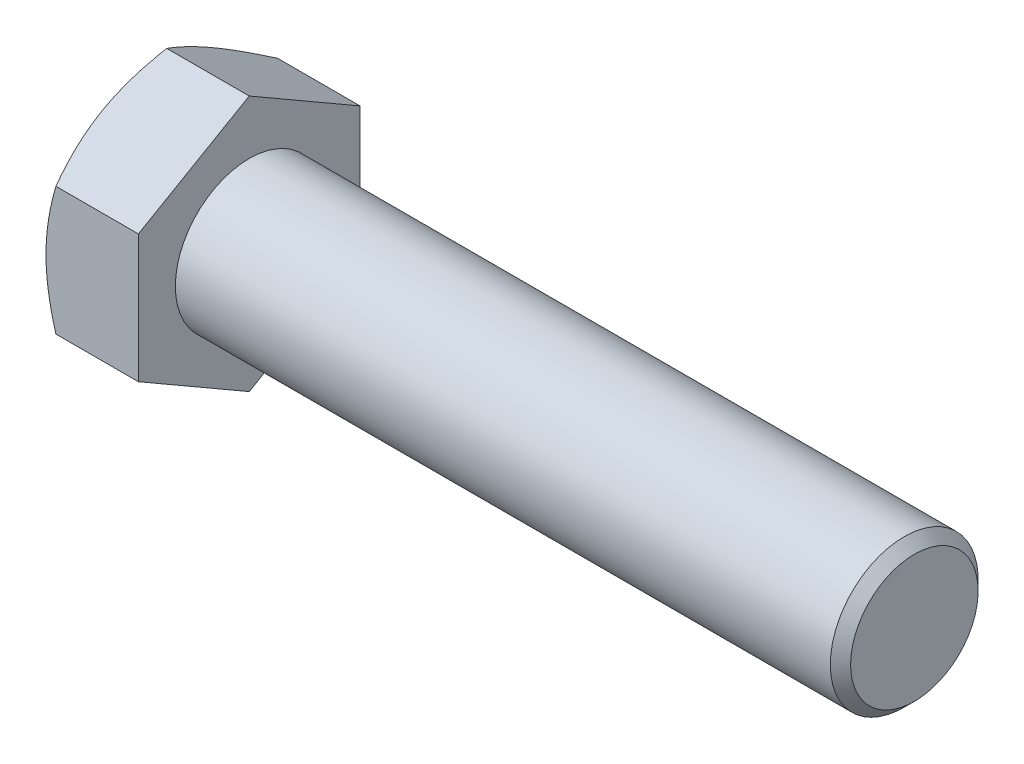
SolidWorks part; units mm, degrees
ref_plane "Plane1" through (0, 0, 0) normal (0, 0, 1) x (1, 0, 0)
ref_plane "Plane2" through (0, 0, 0) normal (0, 1, 0) x (1, 0, 0)
ref_plane "Plane3" through (0, 0, 0) normal (1, 0, 0) x (0, 0, -1)
sketch "Sketch1" plane through (0, 0, 0) normal (1, 0, 0) x (0, 0, -1)
  line L0 (15, 8.6603) -> (15, -8.6603)
  line L1 (-15, 8.6603) -> (-15, -8.6603)
  line L2 (15, -8.6603) -> (0, -17.3205)
  line L3 (0, -17.3205) -> (-15, -8.6603)
  line L4 (15, 8.6603) -> (0, 17.3205)
  line L5 (0, 17.3205) -> (-15, 8.6603)
  dimension "Width_flats" = 30
  dimension "D2" = 120
  dimension "D3" = 15
  dimension "D4" = 15
  dimension "D5" = 15
extrude "BaseHead" add sketch "Sketch1" along normal blind 12.5
sketch "BodySke" plane through (0, 0, 0) normal (0, 0, 1) x (1, 0, 0)
  line L1 (0, 0) -> (102.5, 0)
  line L2 (0, 0) -> (0, 10)
  line L4 (102.5, 0) -> (102.5, 8.626)
  line L5 (12.5, 17.3205) -> (12.5, 8.6603) construction
  line L6 (102.5, 8.626) -> (101.126, 10)
  line L7 (0, 0) -> (110.49, 0) construction
  line L8 (102.5, -8.626) -> (101.126, -10) construction
  line L9 (0, 8.6603) -> (0, -8.6603) construction
  line L10 (15, 15.24) -> (15, -1.27) construction
  line L11 (56.5, 15.24) -> (56.5, -1.27) construction
  line L12 (12.5, 8.6603) -> (12.5, -8.6603) construction
  line L15 (0, 10) -> (101.126, 10)
  dimension "Length" = 90
  dimension "Body_ch_ang" = 45
  dimension "Diameter" = 20
  dimension "Minor_dia" = 17.252
  dimension "Advance" = 2.5
  dimension "Thread_nom" = 46
revolve "BaseBody" add sketch "BodySke" angle 360 about L7
fillet "HeadFillet" [suppressed] radius 0.8
sketch "Sketch3" plane through (0, 0, 0) normal (0, 0, 1) x (1, 0, 0)
  line L0 (0, 15) -> (4.2265, 22.3205)
  line L1 (0, 17.3205) -> (0, 8.6603) construction
  line L2 (4.2265, 22.3205) -> (4.2265, 27.3205)
  line L3 (4.2265, 27.3205) -> (-10, 27.3205)
  line L4 (-10, 27.3205) -> (-10, 15)
  line L5 (-10, 15) -> (0, 15)
  line L6 (0, 0) -> (99.06, 0) construction
  line L7 (12.5, 17.3205) -> (0, 17.3205) construction
  dimension "D1" = 15
  dimension "D2" = 5
  dimension "D3" = 10
  dimension "D4" = 5
  dimension "Head_ch_ang" = 30
revolve "HeadChamfer" cut sketch "Sketch3" angle 360 about L6
sketch "ThdSchSke" plane through (0, 0, 0) normal (0, 0, 1) x (1, 0, 0)
  line L0 (56.5, -8.626) -> (55.5379, -10)
  line L1 (56.5, -8.626) -> (57.4621, -10)
  line L2 (57.4621, -10) -> (57.4621, -12.5)
  line L3 (-3.175, 0) -> (5.1513, 0) construction
  line L5 (57.4621, -12.5) -> (55.5379, -12.5)
  line L6 (55.5379, -12.5) -> (55.5379, -10)
  dimension "Thread_minor" = 17.252
  dimension "Diameter" = 20
  dimension "Start" = 56.5
  dimension "SideAngle" = 55
  dimension "VeeAngle" = 70
  dimension "Overcut" = 25
revolve "ThreadSchematic" [suppressed] cut sketch "ThdSchSke" angle 360 about L3
pattern_linear "ThdSchPat" [suppressed]
equation "\"D3@Sketch1\" = \"Width_flats@Sketch1\" / 2"
equation "\"D4@Sketch1\" = \"D3@Sketch1\""
equation "\"D5@Sketch1\" = \"D4@Sketch1\""
equation "\"Thread_minor@ThreadCosmetic\" = \"Minor_dia@BodySke\""
equation "\"D1@Sketch3\" = \"Width_flats@Sketch1\" / 2"
equation "\"Thread_length@ThreadCosmetic\" = ((sgn( (\"Length@BodySke\" - \"Advance@BodySke\" ) - \"Thread_nom@BodySke\" )-1)*( (\"Length@BodySke\" - \"Advance@BodySke\" ) - \"Thread_nom@BodySke\" ))/-2+ \"Thread_nom@BodySke\""
equation "\"Thread_minor@ThdSchSke\" = \"Minor_dia@BodySke\""
equation "\"Diameter@ThdSchSke\" = \"Diameter@BodySke\""
equation "\"Overcut@ThdSchSke\" = \"Diameter@BodySke\" * 1.25"
equation "\"Start@ThdSchSke\" = \"Head_ht@BaseHead\" + \"Length@BodySke\" - \"Thread_length@ThreadCosmetic\"  '---Non-countersunk---"
equation "\"Num_threads@ThdSchPat\" = int( \"Thread_length@ThreadCosmetic\" / \"Advance@BodySke\" + 0.999 )  + 1"
equation "\"Advance@ThdSchPat\" = \"Thread_length@ThreadCosmetic\" /  (\"Num_threads@ThdSchPat\" - 1) 'relax it"
equation "\"Num_threads@ThdSchPat\" = \"Num_threads@ThdSchPat\" - sgn( \"Num_threads@ThdSchPat\" - 1) '---chamfered tips only---"
